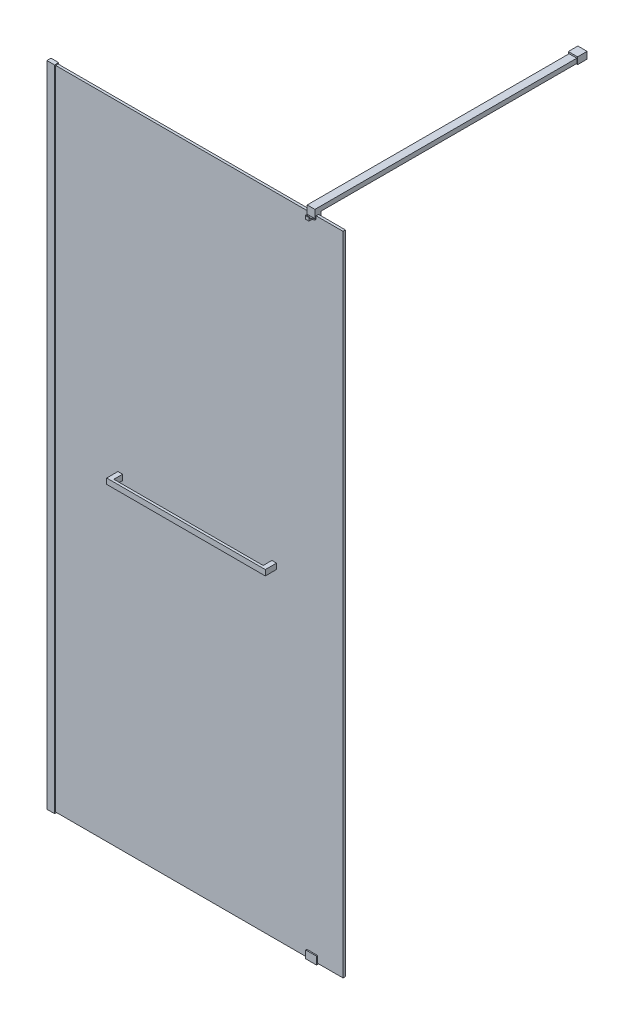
SolidWorks part; units mm, degrees
ref_plane "Płaszczyzna przednia" through (0, 0, 0) normal (0, 0, 1) x (1, 0, 0)
ref_plane "Płaszczyzna górna" through (0, 0, 0) normal (0, 1, 0) x (1, 0, 0)
ref_plane "Płaszczyzna prawa" through (0, 0, 0) normal (1, 0, 0) x (0, 0, -1)
sketch "Szkic1" plane through (0, 0, 0) normal (0, 1, 0) x (1, 0, 0)
  line L0 (0, 0) -> (0, 13.3)
  line L2 (0, 13.3) -> (25, 13.3)
  line L3 (25, 13.3) -> (25, 11.4)
  line L4 (25, 11.4) -> (11.45, 11.4)
  line L5 (11.45, 11.4) -> (11.45, 3.4)
  line L6 (11.45, 3.4) -> (25, 3.4)
  line L7 (25, 3.4) -> (25, 0)
  line L8 (25, 0) -> (0, 0)
  dimension "D1" = 13.3
  dimension "D4" = 1.9
  dimension "D5" = 8
  dimension "D6" = 3.4
  dimension "D7" = 13.55
  dimension "D8" = 25
extrude "Dodanie-wyciągnięcie1" add sketch "Szkic1" along normal blind 2100
sketch "Szkic2" plane through (0, 0, 0) normal (0, -1, 0) x (1, 0, 0)
  line L0 (11.45, -3.4) -> (958.45, -3.4)
  line L1 (11.45, -3.4) -> (11.45, -11.4)
  line L2 (958.45, -3.4) -> (958.45, -11.4)
  line L3 (11.45, -11.4) -> (958.45, -11.4)
  line L4 (11.45, -11.4) -> (25, -11.4) construction
  dimension "D1" = 947
extrude "Dodanie-wyciągnięcie2" add sketch "Szkic2" against normal blind 2100 separate body
sketch "Szkic4" plane through (0, 2100, 0) normal (0, 1, 0) x (1, 0, 0)
  line L1 (25, 13.3) -> (0, 13.3) construction
  line L2 (25, 11.4) -> (25, 13.3) construction
  line L3 (0, 13.3) -> (0, 0) construction
  line L5 (0, 0) -> (25, 0) construction
  line L7 (25, 13.3) -> (0, 13.3)
  line L8 (25, 0) -> (25, 13.3)
  line L9 (0, 13.3) -> (0, 0)
  line L11 (0, 0) -> (25, 0)
extrude "Dodanie-wyciągnięcie3" add sketch "Szkic4" along normal blind 3
sketch "Szkic5" plane through (0, 0, 0) normal (0, -1, 0) x (1, 0, 0)
  line L1 (0, 0) -> (25, 0) construction
  line L2 (25, 0) -> (25, -3.4) construction
  line L3 (0, -13.3) -> (0, 0) construction
  line L5 (25, -13.3) -> (0, -13.3) construction
  line L7 (0, 0) -> (25, 0)
  line L8 (25, 0) -> (25, -13.3)
  line L9 (0, -13.3) -> (0, 0)
  line L11 (25, -13.3) -> (0, -13.3)
extrude "Dodanie-wyciągnięcie4" add sketch "Szkic5" along normal blind 3
ref_plane "Płaszczyzna1" through (858.45, 0, 0) normal (1, 0, 0) x (0, 0, -1)
sketch "Szkic6" plane through (858.45, 0, 0) normal (1, 0, 0) x (0, 0, -1)
  line L0 (11.4, 22) -> (15.75, 22)
  line L1 (15.75, 22) -> (15.75, -3)
  line L2 (15.75, -3) -> (-0.35, -3)
  line L3 (-0.35, -3) -> (-0.35, 22)
  line L4 (-0.35, 22) -> (3.4, 22)
  line L5 (11.4, 22) -> (11.4, 0)
  line L6 (11.4, 0) -> (11.4, 2100)
  line L7 (11.4, 0) -> (11.4, 2100) construction
  line L8 (3.4, 2100) -> (3.4, 0)
  line L9 (3.4, 2100) -> (3.4, 0) construction
  line L10 (11.4, 0) -> (3.4, 0)
  line L11 (3.4, 0) -> (3.4, 22)
  dimension "D1" = 4.35
  dimension "D2" = 25
  dimension "D3" = 3
  dimension "D4" = 3.75
extrude "Dodanie-wyciągnięcie5" add sketch "Szkic6" along normal mid plane 35 separate body
sketch "Szkic7" plane through (858.45, 0, 0) normal (1, 0, 0) x (0, 0, -1)
  line L0 (3.4, 2100) -> (3.4, 0) construction
  line L1 (-0.6, 2120) -> (19.4, 2120)
  line L2 (3.4, 2100) -> (3.4, 0) construction
  line L4 (11.4, 2100) -> (3.4, 2100) construction
  line L13 (11.4, 2100) -> (11.4, 0) construction
  line L20 (19.4, 2120) -> (19.4, 2090)
  line L25 (19.4, 2090) -> (11.4, 2090)
  line L26 (11.4, 2090) -> (11.4, 2100)
  line L27 (11.4, 2100) -> (3.4, 2100)
  line L28 (3.4, 2100) -> (3.4, 2090)
  line L29 (3.4, 2090) -> (-13.37, 2090)
  line L30 (-13.37, 2090) -> (-13.37, 2100)
  line L31 (-13.37, 2100) -> (-10.37, 2100)
  line L32 (-10.37, 2100) -> (-9.8451, 2094)
  line L33 (-9.8451, 2094) -> (-0.6, 2094)
  line L34 (-0.6, 2094) -> (-0.6, 2120)
  dimension "D3" = 20
  dimension "D4" = 30
  dimension "D5" = 16.77
  dimension "D6" = 4
  dimension "D14" = 8
  dimension "D21" = 10
  dimension "D22" = 4
  dimension "D23" = 3
  dimension "D24" = 95
extrude "Dodanie-wyciągnięcie6" add sketch "Szkic7" along normal mid plane 25 separate body
sketch "Szkic8" plane through (0, 2100, 0) normal (0, 1, 0) x (1, 0, 0)
  line L0 (845.95, -0.6) -> (852.45, -3.631)
  line L1 (852.45, -3.631) -> (852.45, -13.37)
  line L2 (870.95, -0.6) -> (864.45, -3.631)
  line L3 (864.45, -3.631) -> (864.45, -13.37)
  line L4 (858.45, -10.37) -> (858.45, 156.6902) construction
  line L5 (870.95, -10.37) -> (845.95, -10.37) construction
  line L6 (852.45, -13.37) -> (864.45, -13.37)
  line L7 (870.95, -13.37) -> (845.95, -13.37) construction
  dimension "D1" = 12
  dimension "D2" = 115
extrude "Wytnij-wyciągnięcie1" cut sketch "Szkic8" against normal through all and the other way through all
sketch "Szkic10" plane through (0, 2120, 0) normal (0, 1, 0) x (1, 0, 0)
  line L0 (858.45, 31.9) -> (858.45, 19.4) construction
  line L1 (845.95, 881.03) -> (870.95, 881.03)
  line L2 (845.95, 881.03) -> (845.95, 19.4)
  line L3 (845.95, 19.4) -> (870.95, 19.4)
  line L4 (870.95, 19.4) -> (845.95, 19.4) construction
  line L5 (845.95, 19.4) -> (845.95, -0.6) construction
  line L6 (870.95, 881.03) -> (870.95, 19.4)
  point P4 (858.45, 31.9)
  dimension "D2" = 861.63
  dimension "D1" = 25
  dimension "D3" = 12.5
extrude "Dodanie-wyciągnięcie7" add sketch "Szkic10" against normal blind 15
sketch "Szkic14" plane through (0, 0, -881.03) normal (0, 0, -1) x (-1, 0, 0)
  line L1 (-873.45, 2125) -> (-843.45, 2125)
  line L2 (-873.45, 2125) -> (-873.45, 2103)
  line L3 (-873.45, 2103) -> (-843.45, 2103)
  line L4 (-843.45, 2125) -> (-843.45, 2103)
  line L5 (-873.45, 2125) -> (-843.45, 2103) construction
  line L6 (-873.45, 2103) -> (-843.45, 2125) construction
  line L7 (-858.45, 2120) -> (-858.45, 2114) construction
  line L8 (-870.95, 2120) -> (-845.95, 2120) construction
  line L9 (-870.95, 2105) -> (-845.95, 2105) construction
  point P0 (-858.45, 2114)
  dimension "D1" = 30
  dimension "D2" = 22
  dimension "D3" = 2
extrude "Dodanie-wyciągnięcie8" add sketch "Szkic14" against normal blind 31
sketch "Szkic17" plane through (0, 0, -3.4) normal (0, 0, 1) x (1, 0, 0)
  line L0 (484.95, 2100) -> (484.95, 1050) construction
  line L1 (958.45, 2100) -> (11.45, 2100) construction
  line L2 (484.95, 1050) -> (484.95, 0) construction
  line L3 (958.45, 0) -> (11.45, 0) construction
  line L4 (234.95, 1050) -> (734.95, 1050) construction
  line L6 (227.45, 1059) -> (242.45, 1059)
  line L7 (227.45, 1059) -> (227.45, 1041)
  line L8 (227.45, 1041) -> (242.45, 1041)
  line L9 (242.45, 1059) -> (242.45, 1041)
  line L10 (227.45, 1059) -> (242.45, 1041) construction
  line L11 (227.45, 1041) -> (242.45, 1059) construction
  line L12 (727.45, 1059) -> (742.45, 1059)
  line L13 (727.45, 1059) -> (727.45, 1041)
  line L14 (727.45, 1041) -> (742.45, 1041)
  line L15 (742.45, 1059) -> (742.45, 1041)
  line L16 (727.45, 1059) -> (742.45, 1041) construction
  line L17 (727.45, 1041) -> (742.45, 1059) construction
  dimension "D1" = 500
  dimension "D2" = 15
  dimension "D3" = 18
extrude "polka_1a" add sketch "Szkic17" along normal blind 36.5 and the other way blind 31 separate body
sketch "Szkic18" plane through (227.45, 0, 0) normal (-1, 0, 0) x (0, 0, 1)
  line L0 (-34.4, 1059) -> (-34.4, 1041) construction
  line L1 (-34.4, 1053.73) -> (-21.6, 1053.73)
  line L2 (-34.4, 1053.73) -> (-34.4, 1045.73)
  line L3 (-34.4, 1045.73) -> (-21.6, 1045.73)
  line L4 (-21.6, 1053.73) -> (-21.6, 1045.73)
  line L5 (-34.4, 1041) -> (33.1, 1041) construction
  dimension "D1" = 4.73
  dimension "D2" = 8
  dimension "D3" = 12.8
extrude "polka_1b" cut sketch "Szkic18" against normal up to surface (515 mm away)
sketch "Szkic19" plane through (0, 1059, 0) normal (0, 1, 0) x (1, 0, 0)
  line L0 (742.45, 21.6) -> (227.45, 21.6)
  line L1 (742.45, 21.6) -> (742.45, 101.6)
  line L2 (227.45, 21.6) -> (227.45, 101.6)
  line L3 (742.45, 101.6) -> (227.45, 101.6)
  line L4 (742.45, 34.4) -> (742.45, -33.1) construction
  line L5 (227.45, 34.4) -> (227.45, -33.1) construction
  line L6 (11.45, 11.4) -> (958.45, 11.4) construction
  dimension "D1" = 10.2
  dimension "D2" = 80
extrude "polka_1c" add sketch "Szkic19" against normal blind 8 from offset 5.28 separate body
sketch "Szkic20" plane through (242.45, 0, 0) normal (1, 0, 0) x (0, 0, -1)
  line L0 (34.4, 1041) -> (-33.1, 1041) construction
  line L1 (-33.1, 1059) -> (-25.1, 1059)
  line L2 (-33.1, 1059) -> (-33.1, 1041)
  line L3 (-33.1, 1041) -> (-25.1, 1041)
  line L4 (-25.1, 1059) -> (-25.1, 1041)
  dimension "D1" = 8
extrude "polka_1d" add sketch "Szkic20" along normal up to surface (485 mm away)
